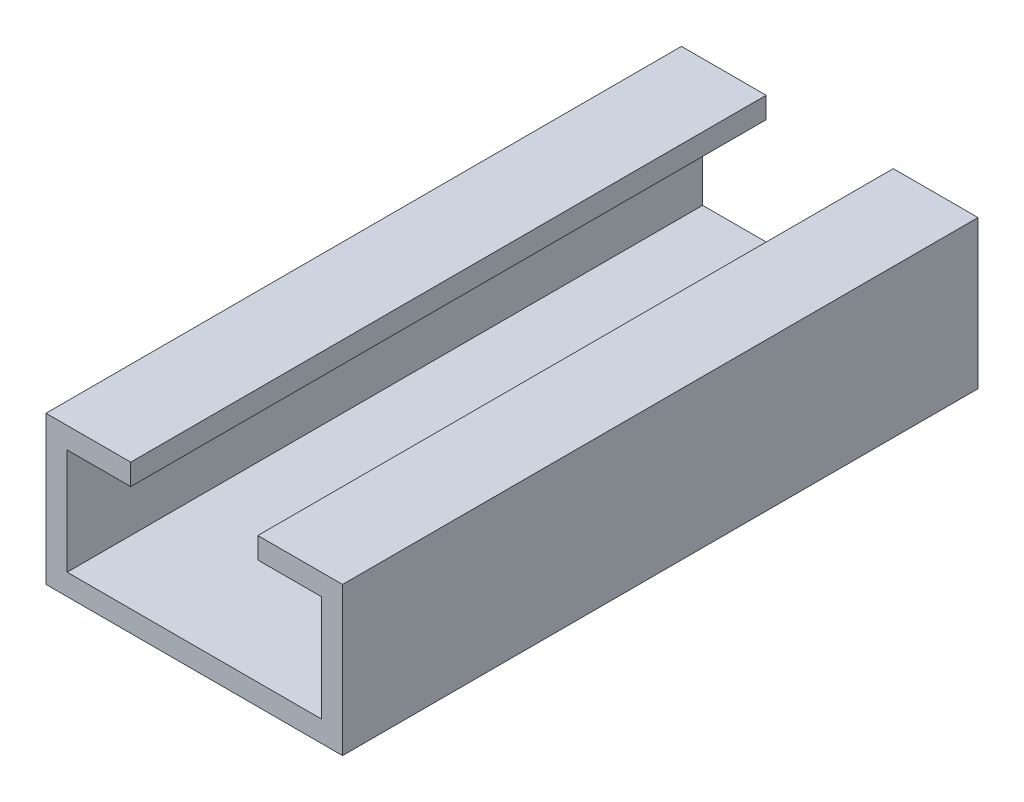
SolidWorks part; units mm, degrees
ref_plane "Plan de face" through (0, 0, 0) normal (0, 0, 1) x (1, 0, 0)
ref_plane "Plan de dessus" through (0, 0, 0) normal (0, 1, 0) x (1, 0, 0)
ref_plane "Plan de droite" through (0, 0, 0) normal (1, 0, 0) x (0, 0, -1)
sketch "Esquisse1" plane through (0, 0, 0) normal (0, 0, 1) x (1, 0, 0)
  line L0 (-12, 12) -> (-6, 12)
  line L1 (-14, 0) -> (14, 0)
  line L2 (-14, 0) -> (-14, 14)
  line L3 (-14, 14) -> (-6, 14)
  line L4 (14, 0) -> (14, 14)
  line L5 (12, 2) -> (12, 12)
  line L6 (-12, 2) -> (12, 2)
  line L7 (-12, 2) -> (-12, 12)
  line L8 (0, 21.1289) -> (0, -11.4843) construction
  line L9 (-6, 14) -> (-6, 12)
  line L10 (6, 14) -> (14, 14)
  line L11 (6, 12) -> (6, 14)
  line L12 (6, 12) -> (12, 12)
  line L13 (-12, 12) -> (12, 12) construction
  line L14 (-14, 14) -> (14, 14) construction
  dimension "D1" = 14
  dimension "D2" = 28
  dimension "D3" = 14
  dimension "D5" = 12
  dimension "D6" = 6
  dimension "D4" = 2
extrude "Extrusion1" add sketch "Esquisse1" along normal blind 60
